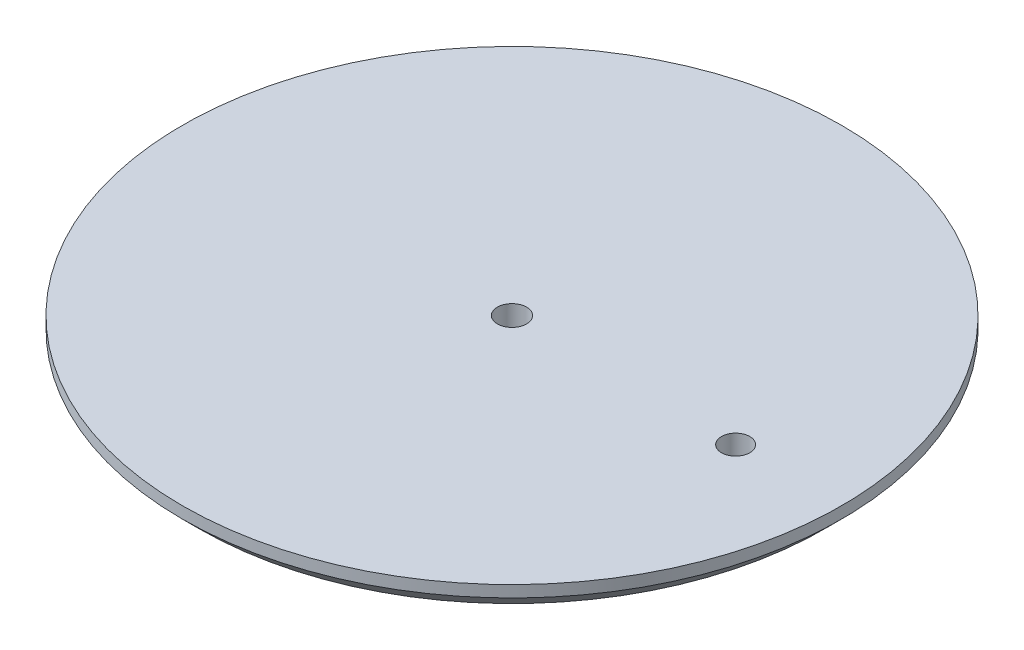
SolidWorks part; units mm, degrees
ref_plane "Plan de face" through (0, 0, 0) normal (0, 0, 1) x (1, 0, 0)
ref_plane "Plan de dessus" through (0, 0, 0) normal (0, 1, 0) x (1, 0, 0)
ref_plane "Plan de droite" through (0, 0, 0) normal (1, 0, 0) x (0, 0, -1)
sketch "Esquisse1" plane through (0, 0, 0) normal (0, 0, 1) x (1, 0, 0)
  line L0 (-56.3835, 0) -> (88.3562, 0) construction
  line L1 (35, 19.562) -> (35, -24.8631) construction
  line L2 (-6, 6) -> (82.9706, 6) construction
  line L3 (57.2677, -9.1967) -> (88.6876, 22.2232) construction
  line L4 (37.4645, 6) -> (37.4645, 4.9754) construction
  line L5 (35, 6) -> (0, 6)
  line L6 (0, 6) -> (0, 0)
  line L7 (0, 0) -> (31.4645, 0)
  line L8 (35, 6) -> (70, 6)
  line L9 (72.4645, 6) -> (72.4645, 1.5962) construction
  line L10 (0, 18.0759) -> (0, -29.4515) construction
  line L11 (70, 20.3504) -> (70, -17.625) construction
  line L12 (70, 6) -> (70, 3.5355)
  line L13 (70, 3.5355) -> (66.4645, 0)
  line L14 (66.4645, 0) -> (31.4645, 0)
  circle A0 centre (35, 0) radius 2.5 construction
  circle A1 centre (70, 0) radius 2.5 construction
  dimension "D1" = 45
revolve "Révolution1" add sketch "Esquisse1" angle 360 about L10
sketch "Esquisse2" plane through (0, 6, 0) normal (0, 1, 0) x (-1, 0, 0)
  circle A0 centre (0, 0) radius 3.1
  circle A1 centre (-47.5, 0) radius 3
  dimension "D1" = 47.5
extrude "Enlèv. mat.-Extru.1" cut sketch "Esquisse2" against normal through all
